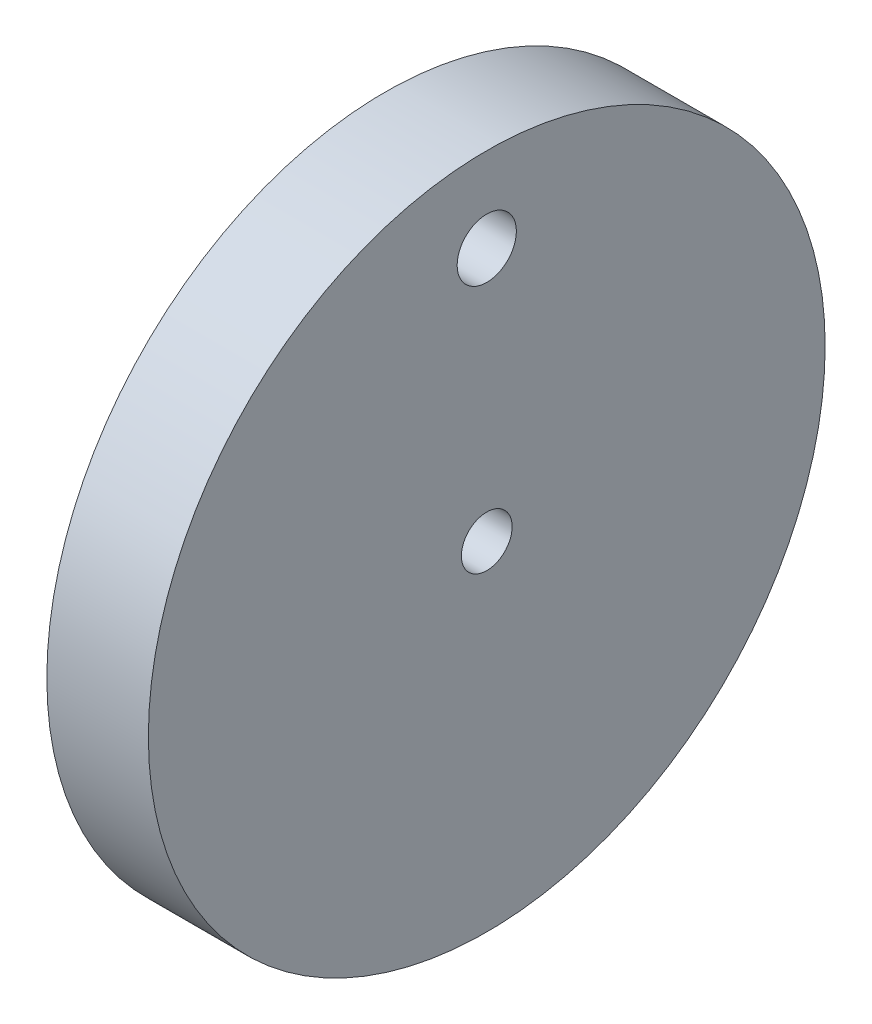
SolidWorks part; units mm, degrees
ref_plane "Front Plane" through (0, 0, 0) normal (0, 0, 1) x (1, 0, 0)
ref_plane "Top Plane" through (0, 0, 0) normal (0, 1, 0) x (1, 0, 0)
ref_plane "Right Plane" through (0, 0, 0) normal (1, 0, 0) x (0, 0, -1)
sketch "Sketch1" plane through (0, 0, 0) normal (1, 0, 0) x (0, 0, -1)
  line L0 (0, 0) -> (0, 20) construction
  circle A0 centre (0, 0) radius 20
  circle A1 centre (0, 0) radius 1.5
  circle A2 centre (0, 15) radius 1.75
  dimension "D1" = 40
  dimension "D2" = 3
  dimension "D3" = 3.5
  dimension "D4" = 15
extrude "Extrude1" add sketch "Sketch1" along normal blind 6
sketch "Sketch2" plane through (0, 0, 0) normal (-1, 0, 0) x (0, 0, 1)
  circle A0 centre (0, 15) radius 3.25
  dimension "D1" = 6.5
extrude "Extrude2" cut sketch "Sketch2" against normal blind 3
